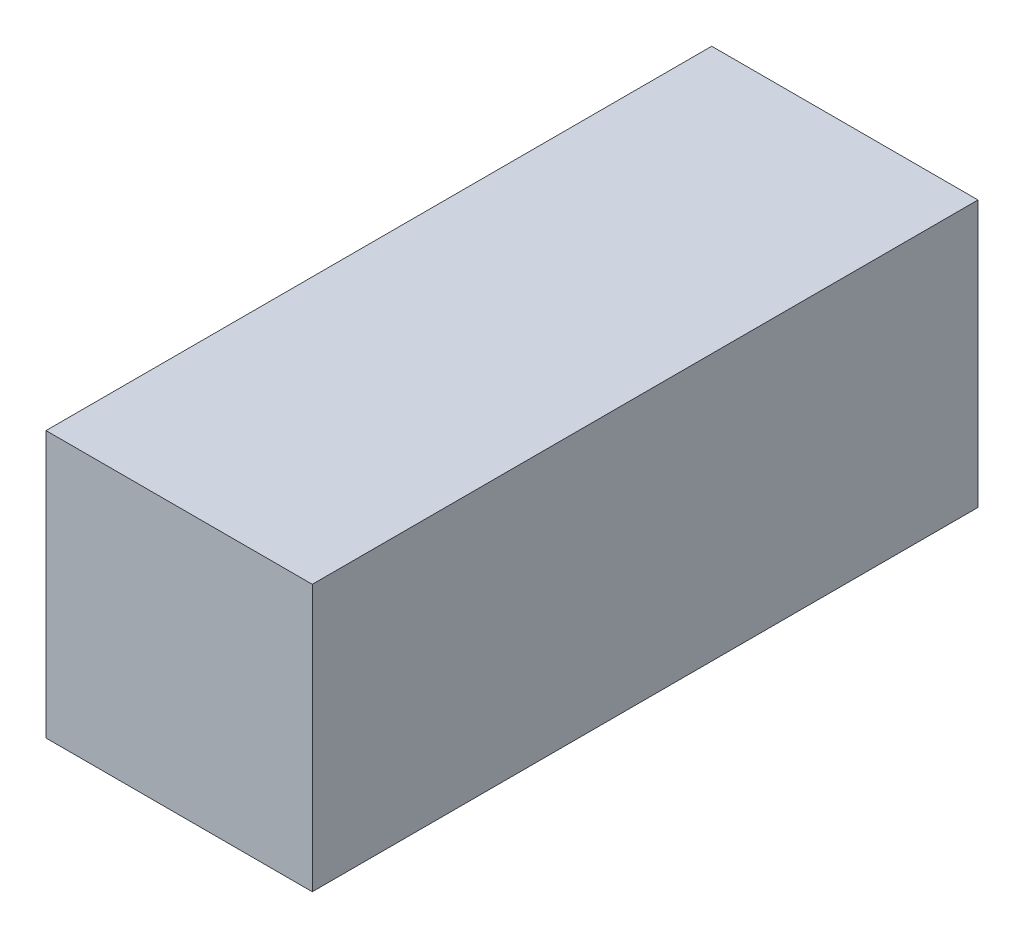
SolidWorks part; units mm, degrees
ref_plane "Ebene vorne" through (0, 0, 0) normal (0, 0, 1) x (1, 0, 0)
ref_plane "Ebene oben" through (0, 0, 0) normal (0, 1, 0) x (1, 0, 0)
ref_plane "Ebene rechts" through (0, 0, 0) normal (1, 0, 0) x (0, 0, -1)
sketch "Skizze1" plane through (0, 0, 0) normal (0, 0, 1) x (1, 0, 0)
  line L1 (0, 0) -> (-40, 0)
  line L2 (0, 0) -> (0, -40)
  line L3 (0, -40) -> (-40, -40)
  line L4 (-40, 0) -> (-40, -40)
  dimension "D1" = 40
  dimension "D2" = 40
extrude "Aufsatz-Linear austragen1" add sketch "Skizze1" along normal blind 100
